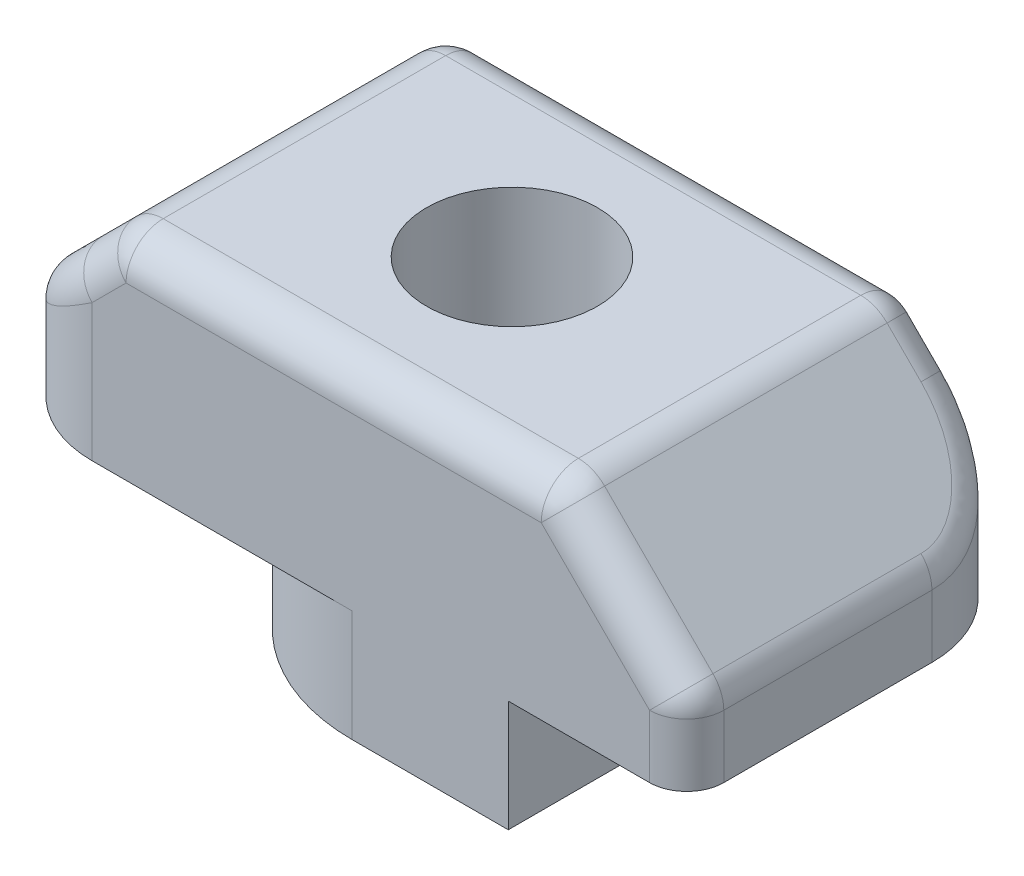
SolidWorks part; units mm, degrees
ref_plane "Front Plane" through (0, 0, 0) normal (0, 0, 1) x (1, 0, 0)
ref_plane "Top Plane" through (0, 0, 0) normal (0, 1, 0) x (1, 0, 0)
ref_plane "Right Plane" through (0, 0, 0) normal (1, 0, 0) x (0, 0, -1)
sketch "Sketch1" plane through (0, 0, 0) normal (0, 0, 1) x (1, 0, 0)
  line L1 (-5.8763, 3.3162) -> (13.1237, 3.3162)
  line L2 (-5.8763, 3.3162) -> (-5.8763, -5.2838)
  line L3 (-5.8763, -5.2838) -> (13.1237, -5.2838)
  line L4 (13.1237, 3.3162) -> (13.1237, -5.2838)
  dimension "D1" = 19
  dimension "D2" = 8.6
extrude "Boss-Extrude1" add sketch "Sketch1" along normal blind 9.6
sketch "Sketch2" plane through (0, 0, 0) normal (0, 0, 1) x (1, 0, 0)
  line L0 (-5.8763, -5.2838) -> (13.1237, -5.2838) construction
  line L1 (8.3237, -5.2838) -> (13.1237, -5.2838)
  line L2 (8.3237, -5.2838) -> (8.3237, -2.2838)
  line L3 (8.3237, -2.2838) -> (13.1237, -2.2838)
  line L4 (13.1237, -5.2838) -> (13.1237, -2.2838)
  line L5 (13.1237, -5.2838) -> (13.1237, 3.3162) construction
  line L7 (-5.8763, -5.2838) -> (-1.0763, -5.2838)
  line L8 (-5.8763, -5.2838) -> (-5.8763, -2.2838)
  line L9 (-5.8763, -2.2838) -> (-1.0763, -2.2838)
  line L10 (-1.0763, -5.2838) -> (-1.0763, -2.2838)
  dimension "D1" = 3
  dimension "D2" = 3
  dimension "D3" = 9.4
  dimension "D4" = 4.8
extrude "Cut-Extrude1" cut sketch "Sketch2" along normal up to surface (9.6 mm away)
ref_plane "Plane1" through (0, -5.2838, 0) normal (0, -1, 0) x (-1, 0, 0)
sketch "Sketch3" plane through (0, -5.2838, 0) normal (0, -1, 0) x (-1, 0, 0)
  line L0 (1.0763, 0) -> (-8.3237, 0) construction
  line L1 (1.0763, -9.6) -> (1.0763, 0) construction
  circle A0 centre (-3.6237, -4.8) radius 2.3
  point P4 (-3.6237, 0)
  dimension "D1" = 4.6
  dimension "D2" = 4.8
  dimension "D3" = 4.7
extrude "Cut-Extrude2" cut sketch "Sketch3" against normal blind 9
chamfer "Chamfer1" distance 3.5 angle 45 2 edges at (13.1237, 3.3162, 4.8) (-5.8763, 3.3162, 4.8)
ref_plane "Plane2" through (0, 3.3162, 0) normal (0, 1, 0) x (1, 0, 0)
sketch "Sketch4" plane through (0, 3.3162, 0) normal (0, 1, 0) x (1, 0, 0)
  line L1 (3.7978, -0.7623) -> (0.214, -2.6303)
  line L2 (0.214, -2.6303) -> (0.0399, -6.668)
  line L3 (0.0399, -6.668) -> (3.4496, -8.8377)
  line L4 (3.4496, -8.8377) -> (7.0334, -6.9697)
  line L5 (7.0334, -6.9697) -> (7.2075, -2.932)
  line L6 (7.2075, -2.932) -> (3.7978, -0.7623)
  circle A0 centre (3.6237, -4.8) radius 3.5 construction
  dimension "D1" = 7
fillet "Fillet1" radius 1 4 edges at (-5.8763, -0.1838, 4.8) (-2.3763, 3.3162, 4.8) (13.1237, -0.1838, 4.8) (9.6237, 3.3162, 4.8)
fillet "Fillet2" radius 5.2 2 edges at (-1.0763, -3.7838, 9.6) (8.3237, -3.7838, 0)
fillet "Fillet3" radius 3 2 edges at (13.1237, -1.441, 0) (13.0476, -0.2154, 0)
fillet "Fillet4" radius 3 2 edges at (-5.8763, -1.441, 9.6) (-5.8002, -0.2154, 9.6)
fillet "Fillet5" radius 1 8 edges at (11.7239, 1.2159, 0.4624) (10.0202, 2.9197, 0) (9.5922, 3.24, 0) (3.6237, 3.3162, 0) (-2.3448, 3.24, 0) (-4.1263, 1.5662, 0) (-5.8002, -0.2154, 0) (-5.8763, -1.441, 0)
fillet "Fillet6" radius 1 8 edges at (-4.4765, 1.2159, 9.1376) (-2.7727, 2.9197, 9.6) (-2.3448, 3.24, 9.6) (3.6237, 3.3162, 9.6) (9.5922, 3.24, 9.6) (11.3737, 1.5662, 9.6) (13.0476, -0.2154, 9.6) (13.1237, -1.441, 9.6)
